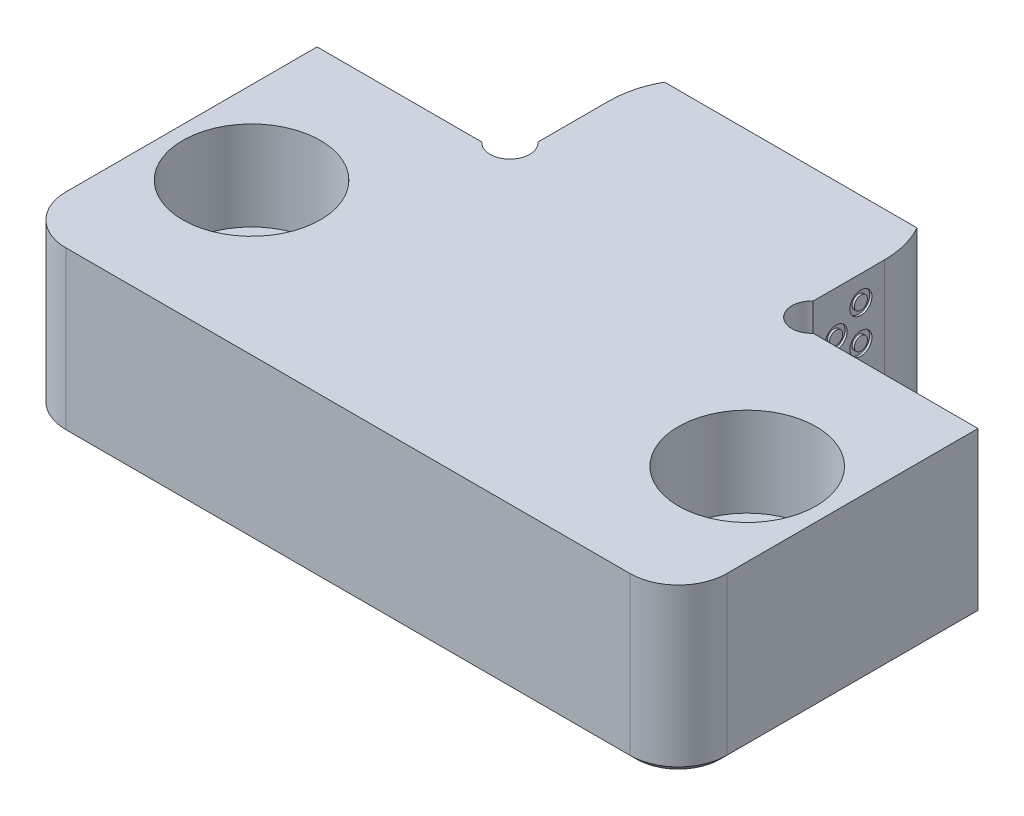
SolidWorks part; units mm, degrees
ref_plane "Front Plane" through (0, 0, 0) normal (0, 0, 1) x (1, 0, 0)
ref_plane "Top Plane" through (0, 0, 0) normal (0, 1, 0) x (1, 0, 0)
ref_plane "Right Plane" through (0, 0, 0) normal (1, 0, 0) x (0, 0, -1)
sketch "Sketch1" plane through (0, 0, 0) normal (0, 1, 0) x (1, 0, 0)
  line L0 (-38.1, -34.544) -> (38.1, -34.544)
  line L6 (-15.8725, 0) -> (-15.8725, 11.43)
  line L7 (-14.5615, 16.51) -> (14.5615, 16.51)
  line L8 (15.8725, 11.43) -> (15.8725, 0)
  line L9 (15.8725, 0) -> (38.1, 0)
  line L10 (38.1, 0) -> (38.1, -34.544)
  line L12 (0, 0) -> (0, 50000) construction
  line L13 (0, 0) -> (-50000, 0) construction
  line L21 (-38.1, 0) -> (-38.1, -34.544)
  line L22 (-15.8725, 0) -> (-38.1, 0)
  arc A0 (-14.5615, 16.51) -> (-15.8725, 11.43) centre (-5.3746, 11.43) ccw
  arc A1 (14.5615, 16.51) -> (15.8725, 11.43) centre (5.3746, 11.43) cw
  dimension "D6" = 10.4978
  dimension "D1" = 31.7449
  dimension "D2" = 34.544
  dimension "D3" = 51.054
  dimension "D4" = 76.2
  dimension "D5" = 5.08
extrude "Boss-Extrude1" add sketch "Sketch1" against normal blind 18.923 separate body
sketch "Sketch3" plane through (0, 0, 0) normal (0, 1, 0) x (1, 0, 0)
  line L0 (0, 0) -> (0, 50000) construction
  line L1 (0, 0) -> (50000, 0) construction
  line L6 (38.1, -0.762) -> (15.8725, -0.762)
  line L7 (38.1, -0.762) -> (15.8725, -0.762) construction
  line L9 (15.1105, 0) -> (15.1105, 11.43)
  line L10 (15.1105, 0) -> (15.1105, 11.43) construction
  circle A0 centre (17.3965, 1.524) radius 2.286
  circle A1 centre (-17.3965, 1.524) radius 2.286
  dimension "D1" = 2.286
  dimension "D2" = 0.762
  dimension "D3" = 0.762
extrude "Cut-Extrude2" cut sketch "Sketch3" against normal through all
sketch "Sketch5" plane through (38.1, 0, 0) normal (1, 0, 0) x (0, 0, -1)
  line L0 (-63.088, -18.669) -> (49936.912, -18.669) construction
  line L1 (-34.544, -18.923) -> (0, -18.923) construction
  line L2 (16.51, -18.923) -> (16.51, 0) construction
  line L3 (0, 9.7237) -> (0, -49990.2763) construction
  line L4 (0, -18.923) -> (0, 0) construction
  line L5 (-17.272, 0) -> (-17.272, 50000) construction
  line L6 (-34.544, 0) -> (0, 0) construction
  line L7 (0, -18.669) -> (0, -45.48)
  line L8 (0, -18.669) -> (1.27, -18.669)
  line L9 (50.8, -7.38) -> (50.8, -45.48)
  line L10 (50.8, -45.48) -> (0, -45.48)
  arc A0 (1.27, -18.669) -> (50.8, -7.38) centre (1.27, 95.631) ccw
  point P16 (-17.272, 0)
  dimension "D2" = 114.3
  dimension "D1" = 0.254
  dimension "D4" = 38.1
  dimension "D5" = 50.8
extrude "Cut-Extrude3" cut sketch "Sketch5" against normal through all
fillet "Fillet1" radius 5.588 2 edges at (-38.1, -9.4615, 34.544) (38.1, -9.4615, 34.544)
chamfer "Chamfer3" distance 0.762 angle 45 5 edges at (-38.1, -18.923, 14.478) (-36.4633, -18.923, 32.9073) (0, -18.923, 34.544) (36.4633, -18.923, 32.9073) (38.1, -18.923, 14.478)
hole_wizard "3/8\" CBORE" positions "Sketch7" profile "Sketch6" counterbore size "3/8" standard "ANSI Inch"
sketch "Sketch7" plane through (0, 0, 0) normal (0, 1, 0) x (-1, 0, 0)
  line L0 (0, 0) -> (0, 50000) construction
  line L1 (0, 0) -> (50000, 0) construction
  line L2 (38.1, 0) -> (38.1, 28.956) construction
  line L3 (32.512, 34.544) -> (-32.512, 34.544) construction
  point P0 (28.575, 17.0815)
  point P16 (-28.575, 17.0815)
  dimension "D1" = 9.525
  dimension "D2" = 17.4625
sketch "Sketch6" plane through (-28.575, 0, 17.0815) normal (1, 0, 0) x (0, 0, 1)
  line L0 (0, 0) -> (0, 18.923)
  line L1 (0, 18.923) -> (5.1587, 18.923)
  line L3 (5.1587, 18.923) -> (5.1587, 10.287)
  line L4 (5.1587, 10.287) -> (7.9375, 10.287)
  line L5 (7.9375, 10.287) -> (7.9375, 0)
  line L7 (7.9375, 0) -> (0, 0)
  line L11 (0, -6.35) -> (0, 107.95) construction
  dimension "Thru Hole Dia." = 10.3175
  dimension "Thru Hole Depth" = 18.923
  dimension "C'Bore Dia." = 15.875
  dimension "C'Bore Depth" = 10.287
sketch "Sketch8" plane through (15.8725, 0, 0) normal (1, 0, 0) x (0, 0, -1)
  circle A0 centre (8.7286, -2.9167) radius 1.27
  circle A1 centre (8.7286, -2.9167) radius 0.762
  circle A2 centre (8.7286, -15.4535) radius 1.27
  circle A3 centre (8.7286, -15.4535) radius 0.762
  circle A4 centre (8.634, -11.2904) radius 1.27
  circle A5 centre (8.634, -11.2904) radius 0.762
  circle A6 centre (8.7286, -6.9853) radius 1.27
  circle A7 centre (8.7286, -6.9853) radius 0.762
  circle A8 centre (5.8693, -4.9918) radius 1.27
  circle A9 centre (5.8693, -4.9918) radius 0.762
  circle A12 centre (5.7747, -13.3654) radius 1.27
  circle A13 centre (5.7747, -13.3654) radius 0.762
  circle A14 centre (5.8693, -9.0603) radius 1.27
  circle A15 centre (5.8693, -9.0603) radius 0.762
extrude "Cut-Extrude4" cut sketch "Sketch8" against normal blind 0.254
mirror "Mirror1" about plane through (0, 0, 0) normal (1, 0, 0) of "Cut-Extrude4"
